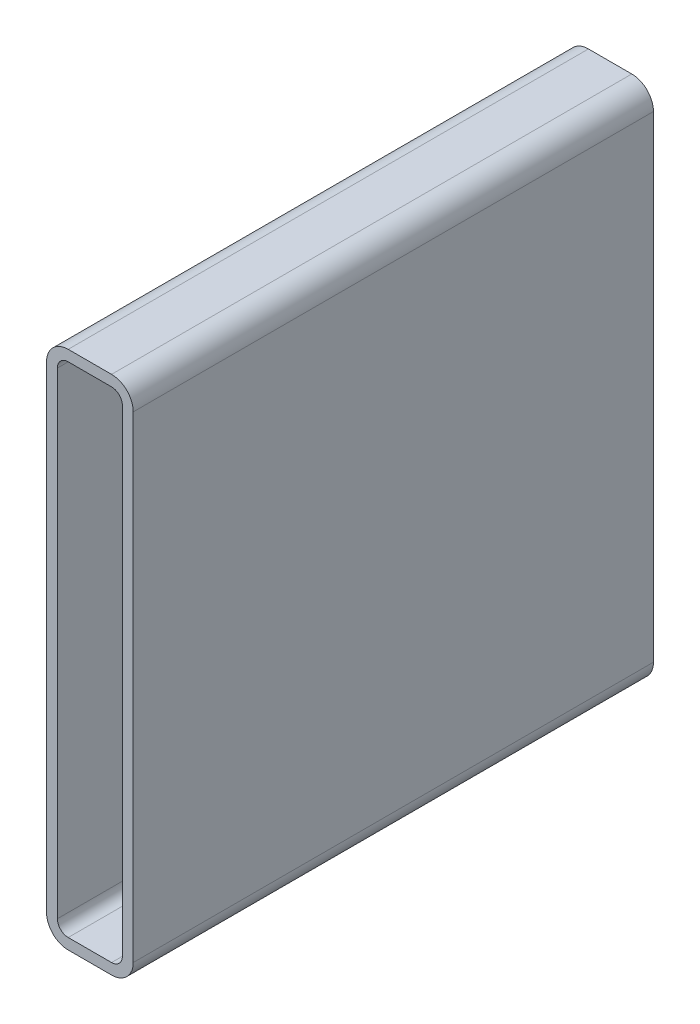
SolidWorks part; units mm, degrees
ref_plane "Front Plane" through (0, 0, 0) normal (0, 0, 1) x (1, 0, 0)
ref_plane "Top Plane" through (0, 0, 0) normal (0, 1, 0) x (1, 0, 0)
ref_plane "Right Plane" through (0, 0, 0) normal (1, 0, 0) x (0, 0, -1)
sketch "Sketch1" plane through (0, 0, 0) normal (0, 0, 1) x (1, 0, 0)
  line B0 (12.7, 304.8) -> (38.1, 304.8)
  arc B1 (50.8, 292.1) -> (38.1, 304.8) centre (38.1, 292.1) ccw
  line B2 (50.8, 292.1) -> (50.8, 12.7)
  arc B3 (38.1, 0) -> (50.8, 12.7) centre (38.1, 12.7) ccw
  line B4 (38.1, 0) -> (12.7, 0)
  arc B5 (0, 12.7) -> (12.7, 0) centre (12.7, 12.7) ccw
  line B6 (0, 12.7) -> (0, 292.1)
  arc B7 (12.7, 304.8) -> (0, 292.1) centre (12.7, 292.1) ccw
  line B8 (12.7, 298.45) -> (38.1, 298.45)
  arc B9 (44.45, 292.1) -> (38.1, 298.45) centre (38.1, 292.1) ccw
  line B10 (44.45, 292.1) -> (44.45, 12.7)
  arc B11 (38.1, 6.35) -> (44.45, 12.7) centre (38.1, 12.7) ccw
  line B12 (38.1, 6.35) -> (12.7, 6.35)
  arc B13 (6.35, 12.7) -> (12.7, 6.35) centre (12.7, 12.7) ccw
  line B14 (6.35, 12.7) -> (6.35, 292.1)
  arc B15 (12.7, 298.45) -> (6.35, 292.1) centre (12.7, 292.1) ccw
sketch_block_instance "HSS12x2x0.250-1"
sketch_block "HSS12x2x0.250"
extrude "Boss-Extrude1" add sketch "Sketch1" along normal blind 304.8
